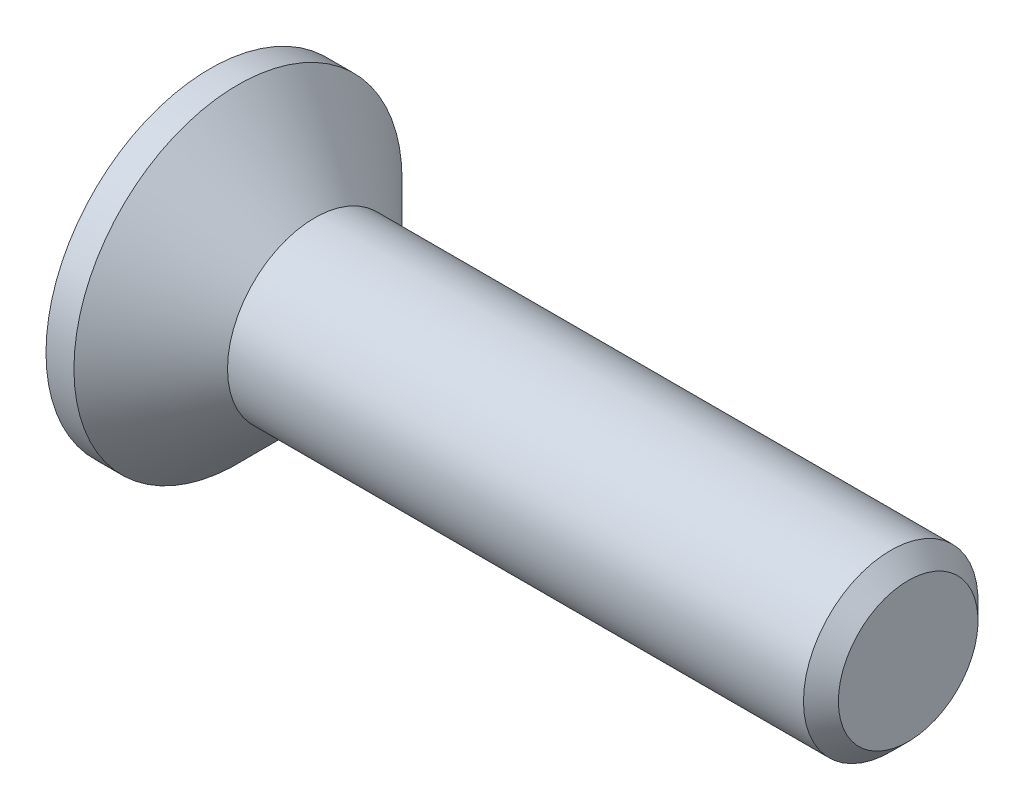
SolidWorks part; units mm, degrees
ref_plane "Front Plane" through (0, 0, 0) normal (0, 0, 1) x (1, 0, 0)
ref_plane "Top Plane" through (0, 0, 0) normal (0, 1, 0) x (1, 0, 0)
ref_plane "Right Plane" through (0, 0, 0) normal (1, 0, 0) x (0, 0, -1)
sketch "Sketch1" plane through (0, 0, 0) normal (0, 0, 1) x (1, 0, 0)
  line L1 (-1.5, 2.35) -> (-1.5, 0)
  line L2 (-1.5, 0) -> (8.5, 0)
  line L3 (8.5, 0) -> (8.5, 1.25)
  line L4 (8.5, 1.25) -> (0, 1.25)
  line L5 (-1.5, 2.35) -> (-1.1, 2.35)
  line L6 (-1.1, 2.35) -> (0, 1.25)
  dimension "D1" = 1.25
  dimension "D2" = 45
  dimension "D3" = 1.5
  dimension "D4" = 10
  dimension "D5" = 2.35
revolve "Revolve1" add sketch "Sketch1" angle 360 about L2
chamfer "Chamfer1" distance 0.25 angle 45 1 edges at (8.5, 0, 1.25)
sketch "Sketch2" plane through (-1.5, 0, 0) normal (-1, 0, 0) x (0, 0, 1)
  line L0 (-0.34, 1.35) -> (0.34, 1.35)
  line L1 (0.34, 1.35) -> (0.34, 0.34)
  line L2 (0.34, 0.34) -> (1.35, 0.34)
  line L3 (1.35, 0.34) -> (1.35, -0.34)
  line L4 (1.35, -0.34) -> (0.34, -0.34)
  line L5 (0.34, -0.34) -> (0.34, -1.35)
  line L6 (0.34, -1.35) -> (-0.34, -1.35)
  line L7 (-0.34, -1.35) -> (-0.34, -0.34)
  line L8 (-0.34, -0.34) -> (-1.35, -0.34)
  line L9 (-1.35, -0.34) -> (-1.35, 0.34)
  line L10 (-1.35, 0.34) -> (-0.34, 0.34)
  line L11 (-0.34, 0.34) -> (-0.34, 1.35)
  point P2 (0, 1.35)
  point P14 (0, -1.35)
  point P15 (1.35, 0)
  point P16 (-1.35, 0)
  dimension "D1" = 2.7
  dimension "D2" = 0.68
extrude "Cut-Extrude1" cut sketch "Sketch2" against normal blind 1.25
